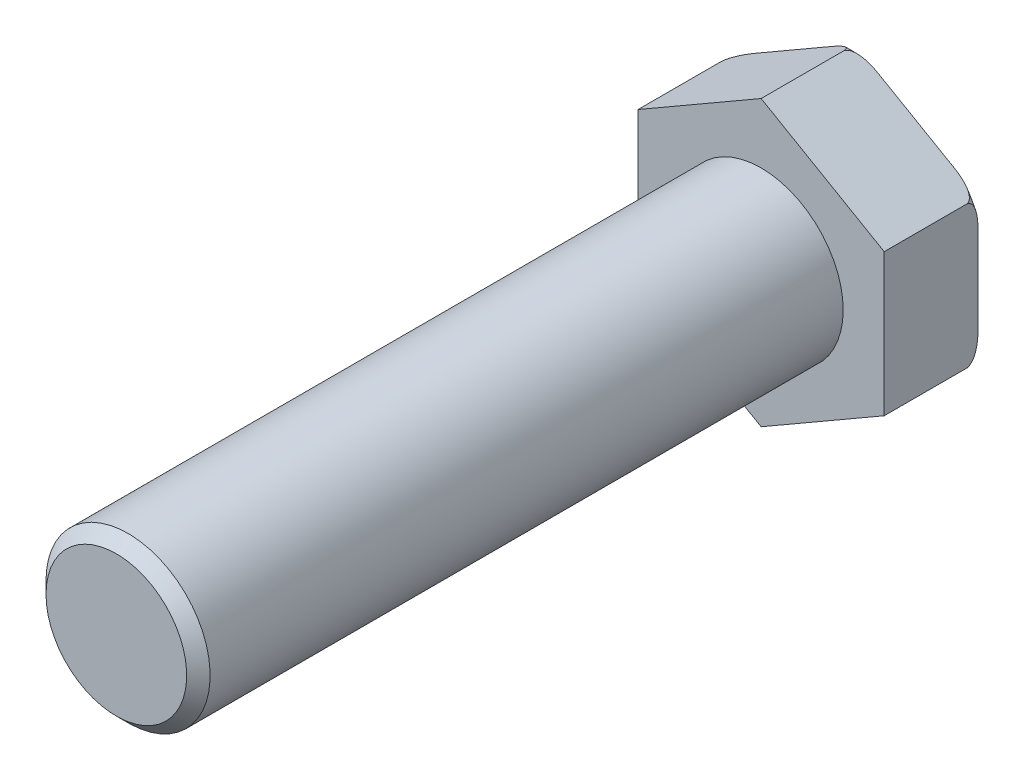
SolidWorks part; units mm, degrees
ref_plane "Plan1" through (0, 0, 0) normal (0, 0, 1) x (1, 0, 0)
ref_plane "Plan2" through (0, 0, 0) normal (0, 1, 0) x (1, 0, 0)
ref_plane "Plan3" through (0, 0, 0) normal (1, 0, 0) x (0, 0, -1)
sketch "profil tête" plane through (0, 0, 0) normal (0, 0, 1) x (1, 0, 0)
  line L0 (0, 12.1244) -> (0, -12.1244) construction
  line L2 (-10.5, 6.0622) -> (-10.5, -6.0622)
  line L3 (10.5, 6.0622) -> (10.5, -6.0622)
  line L4 (-10.5, 6.0622) -> (0, 12.1244)
  line L5 (10.5, 6.0622) -> (0, 12.1244)
  line L6 (-10.5, -6.0622) -> (0, -12.1244)
  line L7 (10.5, -6.0622) -> (0, -12.1244)
  line L8 (-10.5, -6.0622) -> (10.5, 6.0622) construction
  line L9 (-10.5, 6.0622) -> (10.5, -6.0622) construction
  dimension "D1" = 60
  dimension "DIAMETRE" = 21
extrude "TETE" add sketch "profil tête" along normal blind 8
sketch "profil congé" plane through (0, 0, 0) normal (1, 0, 0) x (0, 0, -1)
  line L0 (-1, 12.1244) -> (0, 12.1244)
  line L2 (0, 6.0622) -> (0, 12.1244) construction
  line L3 (0, 12.1244) -> (0, 11.1244)
  line L4 (0, 0) -> (0.4797, 0) construction
  line L5 (-8, 12.1244) -> (0, 12.1244) construction
  arc A0 (-1, 12.1244) -> (0, 11.1244) centre (-1, 11.1244) cw
  dimension "D1" = 1
revolve "CONGE" cut sketch "profil congé" angle 360 about L4
sketch "profil cylindre" plane through (0, 0, 8) normal (0, 0, 1) x (1, 0, 0)
  circle A0 centre (0, 0) radius 7
  dimension "DIAMETRE" = 14
extrude "CYLINDRE FILETE" add sketch "profil cylindre" along normal blind 55
revolve "CHANFREIN FILET" cut sketch "profil chanfrein" angle 360 about L4
sketch "profil chanfrein" plane through (0, 0, 0) normal (1, 0, 0) x (0, 0, -1)
  line L0 (-63, 6) -> (-62, 7)
  line L1 (-63, 7) -> (-63, -7) construction
  line L2 (-63, 7) -> (-62, 7)
  line L3 (-8, 7) -> (-63, 7) construction
  line L4 (-12.0874, 0) -> (-18.1046, 0) construction
  line L5 (-63, 0) -> (-8, 0) construction
  line L8 (-63, 7) -> (-63, 6)
  dimension "D2" = 12
  dimension "D3" = 45
equation "\"D2@profil chanfrein\" = \"DIAMETRE FOND FILET@Représentation de filetage1\""
